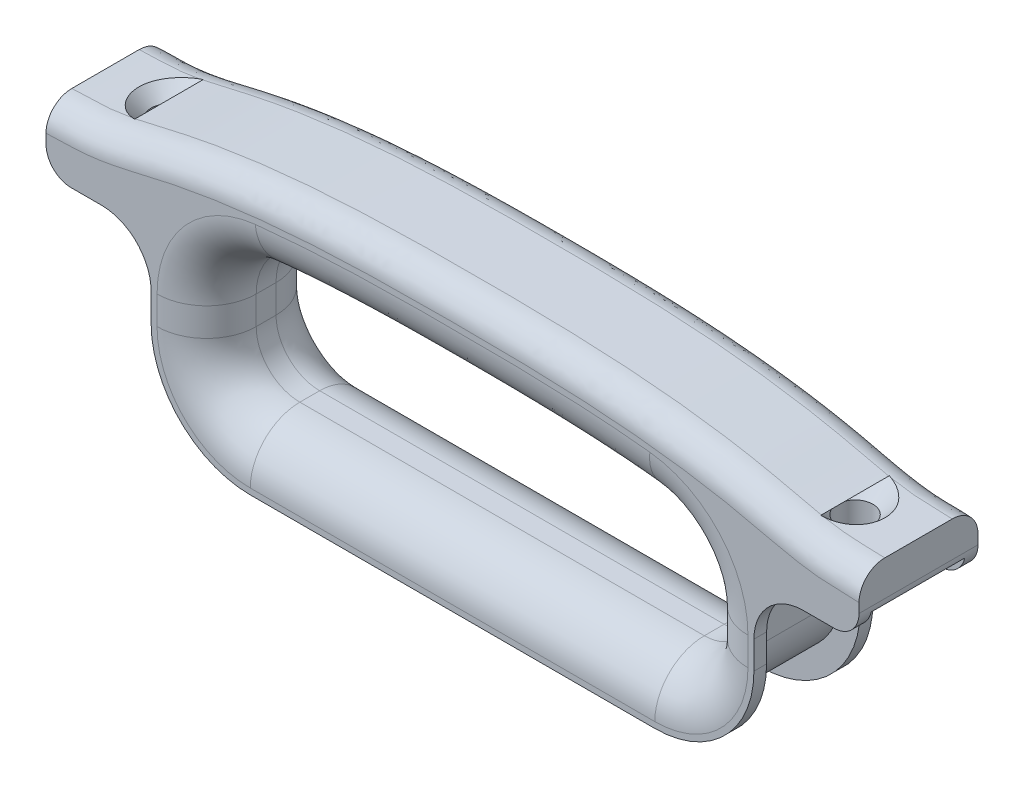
SolidWorks part; units mm, degrees
ref_plane "Front Plane" through (0, 0, 0) normal (0, 0, 1) x (1, 0, 0)
ref_plane "Top Plane" through (0, 0, 0) normal (0, 1, 0) x (1, 0, 0)
ref_plane "Right Plane" through (0, 0, 0) normal (1, 0, 0) x (0, 0, -1)
sketch "Sketch1" plane through (0, 0, 0) normal (0, 0, 1) x (1, 0, 0)
  line L0 (-102.5, 59.75) -> (-102.5, 50.85)
  line L1 (-96.15, 44.5) -> (-88.5, 44.5)
  line L2 (-76, 32) -> (-76, 25)
  line L3 (-51, 0) -> (51, 0)
  line L4 (76, 25) -> (76, 32)
  line L5 (88.5, 44.5) -> (96.15, 44.5)
  line L6 (102.5, 50.85) -> (102.5, 59.75)
  line L7 (-102.5, 59.75) -> (-155.1029, 55.1478) construction
  line L8 (0, -40.2924) -> (0, 129.0844) construction
  line L9 (102.5, 59.75) -> (155.1029, 55.1478) construction
  line L10 (-95, 60) -> (95, 60) construction
  line L11 (-76, 63.5) -> (76, 63.5) construction
  arc A0 (-88.5, 44.5) -> (-76, 32) centre (-88.5, 32) cw
  arc A1 (76, 32) -> (88.5, 44.5) centre (88.5, 32) cw
  arc A2 (-76, 25) -> (-51, 0) centre (-51, 25) ccw
  arc A3 (51, 0) -> (76, 25) centre (51, 25) ccw
  arc A4 (96.15, 44.5) -> (102.5, 50.85) centre (96.15, 50.85) ccw
  arc A5 (-102.5, 50.85) -> (-96.15, 44.5) centre (-96.15, 50.85) ccw
  spline S0 degree 3 poles (-102.5, 59.75) (-100.0278, 59.9663) (-90.9938, 59.641) (-57.5968, 68.9821) (0, 70.3627) (57.5968, 68.9821) (90.9938, 59.641) (100.0278, 59.9663) (102.5, 59.75) knots 0 0 0 0 0.0364 0.130111 0.5 0.869889 0.9636 1 1 1 1
  point P10 (0, 69.75)
  point P12 (-76, 44.5)
  point P17 (76, 44.5)
  point P20 (-76, 0)
  point P23 (76, 0)
  point P29 (-102.5, 44.5)
  dimension "D7" = 12.5
  dimension "D8" = 60
  dimension "D9" = 25
  dimension "D10" = 6.35
  dimension "D2" = 205
  dimension "D3" = 152
  dimension "D4" = 10
  dimension "D5" = 44.5
  dimension "D6" = 15.25
  dimension "D11" = 76
  dimension "D12" = 85
  dimension "D13" = 190
  dimension "D14" = 152
  dimension "D15" = 63.5
extrude "Extrude1" add sketch "Sketch1" along normal mid plane 30
fillet "Fillet1" radius 6.5 2 edges
sketch "Sketch2" plane through (0, 0, 0) normal (0, 0, 1) x (1, 0, 0)
  line L25 (-62, 32) -> (-62, 25)
  line L26 (-51, 14) -> (51, 14)
  line L27 (62, 25) -> (62, 32)
  line L28 (-62, 32.1187) -> (-62, 25)
  line L29 (-51, 14) -> (51, 14)
  line L30 (62, 25) -> (62, 32.1187)
  arc A0 (-48.4004, 47.2791) -> (-62, 32.1187) centre (-46.75, 32.1187) ccw
  arc A1 (62, 32.1187) -> (48.4005, 47.2791) centre (46.75, 32.1187) ccw
  arc A22 (-62, 32) -> (-65.2918, 44.7917) centre (-88.5, 32) ccw
  arc A23 (-62, 25) -> (-51, 14) centre (-51, 25) ccw
  arc A24 (51, 14) -> (62, 25) centre (51, 25) ccw
  arc A25 (65.2918, 44.7917) -> (62, 32) centre (88.5, 32) ccw
  arc A27 (-62, 25) -> (-51, 14) centre (-51, 25) ccw
  arc A28 (51, 14) -> (62, 25) centre (51, 25) ccw
  spline S3 degree 3 poles (255.3566, -2925.4464) (392.9821, -200.0463) (233.3166, 26.5935) (43.73, 47.8027) (38.3009, 48.2302) (27.4129, 48.8355) (21.9541, 49.014) (11.0188, 49.2213) (5.5436, 49.2498) (-10.8706, 49.2505) (-21.8112, 49.1434) (-35.4742, 48.3881) (-38.2079, 48.2054) (-43.664, 47.7639) (-46.3859, 47.5051) (-235.9187, 26.3315) (-388.3506, -205.5356) (-134.5746, -2929.9284) knots -4.132073 -4.132073 -4.132073 -4.132073 0.125 0.125 0.25 0.25 0.375 0.375 0.5 0.5 0.75 0.75 0.8125 0.8125 0.875 0.875 5.176244 5.176244 5.176244 5.176244 only from (65.2918, 44.7917) to (-65.2918, 44.7917)
  spline S4 degree 3 poles (48.4005, 47.2791) (43.2365, 47.8413) (38.0534, 48.2439) (27.4129, 48.8355) (21.9541, 49.014) (11.0188, 49.2213) (5.5436, 49.2498) (-10.8706, 49.2505) (-21.8112, 49.1434) (-35.4742, 48.3881) (-38.2079, 48.2054) (-43.4295, 47.7828) (-45.918, 47.5493) (-48.4004, 47.2791) knots 0.130681 0.130681 0.130681 0.130681 0.25 0.25 0.375 0.375 0.5 0.5 0.75 0.75 0.8125 0.8125 0.869629 0.869629 0.869629 0.869629
  dimension "D3" = 14
  dimension "D1" = 15.25
extrude "Cut-Extrude1" cut sketch "Sketch2" against normal through all and the other way through all
fillet "Fillet2" radius 12.5 16 edges at (-58.7782, 17.2218, -15) (-62, 28.5593, -15) (-58.1019, 42.3018, -15) (58.1019, 42.3018, -15) (62, 28.5593, -15) (58.7782, 17.2218, -15) (-58.7782, 17.2218, 15) (-62, 28.5593, 15) (-58.1019, 42.3018, 15) (58.1019, 42.3018, 15) (62, 28.5593, 15) (58.7782, 17.2218, 15) (0, 14, -15) (0, 14, 15)
sketch "Sketch3" plane through (0, 0, 0) normal (0, 0, 1) x (1, 0, 0)
  line L56 (-108.3568, 49.5) -> (-108.3568, -10.0254)
  line L57 (-51, 6.35) -> (51, 6.35)
  line L58 (-51, 6.35) -> (51, 6.35)
  line L59 (-108.3568, -10.0254) -> (109.3189, -10.0254)
  line L60 (88.5, 49.5) -> (96.15, 49.5)
  line L61 (71, 25) -> (71, 32)
  line L62 (-51, 5) -> (51, 5)
  line L63 (-71, 32) -> (-71, 25)
  line L64 (-96.15, 49.5) -> (-88.5, 49.5)
  line L65 (88.5, 49.5) -> (109.3189, 49.5)
  line L66 (71, 25) -> (71, 32)
  line L67 (109.3189, -10.0254) -> (109.3189, 49.5)
  line L68 (-71, 32) -> (-71, 25)
  line L69 (-108.3568, 49.5) -> (-88.5, 49.5)
  arc A49 (88.5, 49.5) -> (71, 32) centre (88.5, 32) ccw
  arc A50 (51, 5) -> (71, 25) centre (51, 25) ccw
  arc A51 (-71, 25) -> (-51, 5) centre (-51, 25) ccw
  arc A52 (-71, 32) -> (-88.5, 49.5) centre (-88.5, 32) ccw
  arc A53 (88.5, 49.5) -> (71, 32) centre (88.5, 32) ccw
  arc A56 (-71, 32) -> (-88.5, 49.5) centre (-88.5, 32) ccw
  spline S0 degree 3 poles (-71, 25) (-71, 14.2031) (-60.1154, 6.35) (-51, 6.35) knots 0 0 0 0 1 1 1 1
  spline S1 degree 3 poles (51, 6.35) (62.0782, 6.35) (71, 15.8846) (71, 25) knots 0 0 0 0 1 1 1 1
  dimension "D1" = 5
  dimension "D2" = 6.35
extrude "Cut-Extrude2" cut sketch "Sketch3" against normal offset from surface 3.2 and the other way offset from surface (11.8 mm away) 3.2
hole_wizard "M8 FHMS - Normal to Face" positions "3DSketch4" profile "Sketch9" countersink size "M8" standard "Ansi Metric"
sketch3d "3DSketch4"
  point P0 (-86.5, 61.122, 0)
  point P2 (86.5, 61.122, 0)
  dimension "D1" = 16
  dimension "D2" = 16
sketch "Sketch9" plane through (-86.5, 61.122, 0) normal (0, 0, 1) x (-0.9811, -0.1933, 0)
  line L0 (0, 0) -> (0, 96.509)
  line L1 (0, 96.509) -> (4.5, 96.509)
  line L2 (4.5, 96.509) -> (4.5, 4.15)
  line L3 (4.5, 4.15) -> (8.65, 0)
  line L5 (8.65, 0) -> (0, 0)
  line L6 (-4.5, 4.15) -> (-8.65, 0) construction
  line L11 (0, -6.35) -> (0, 107.95) construction
  dimension "Thru Hole Dia." = 9
  dimension "Thru Hole Depth" = 96.509
  dimension "Near C'Sink Dia." = 17.3
  dimension "Near C'Sink Angle" = 90
sketch3d "3DSketch2"
  point P0 (86.5, 61.122, 0)
  dimension "D1" = 16
ref_plane "Plane for Hole Wizard" through (0, 61.122, 0) normal (0, 1, 0) x (-1, 0, 0)
hole_wizard "CSK for M8 Flat Head Machine Screw1" positions "Sketch8" profile "Sketch7" countersink size "M8" standard "Ansi Metric"
sketch "Sketch8" plane through (0, 61.122, 0) normal (0, 1, 0) x (-1, 0, 0)
  line L0 (50, 0) -> (-50, 0) construction
  line L1 (-102.5, 15) -> (-102.5, -15) construction
  line L2 (102.5, 15) -> (102.5, -15) construction
  point P0 (-86.5, 0)
  point P7 (86.5, 0)
  dimension "D1" = 16
  dimension "D2" = 16
sketch "Sketch7" plane through (86.5, 61.122, 0) normal (1, 0, 0) x (0, 0, 1)
  line L0 (0, 0) -> (0, 61.122)
  line L1 (0, 61.122) -> (4.5, 61.122)
  line L2 (4.5, 61.122) -> (4.5, 4.15)
  line L3 (4.5, 4.15) -> (8.65, 0)
  line L5 (8.65, 0) -> (0, 0)
  line L6 (-4.5, 4.15) -> (-8.65, 0) construction
  line L11 (0, -6.35) -> (0, 107.95) construction
  dimension "Thru Hole Dia." = 9
  dimension "Thru Hole Depth" = 61.122
  dimension "Near C'Sink Dia." = 17.3
  dimension "Near C'Sink Angle" = 90
